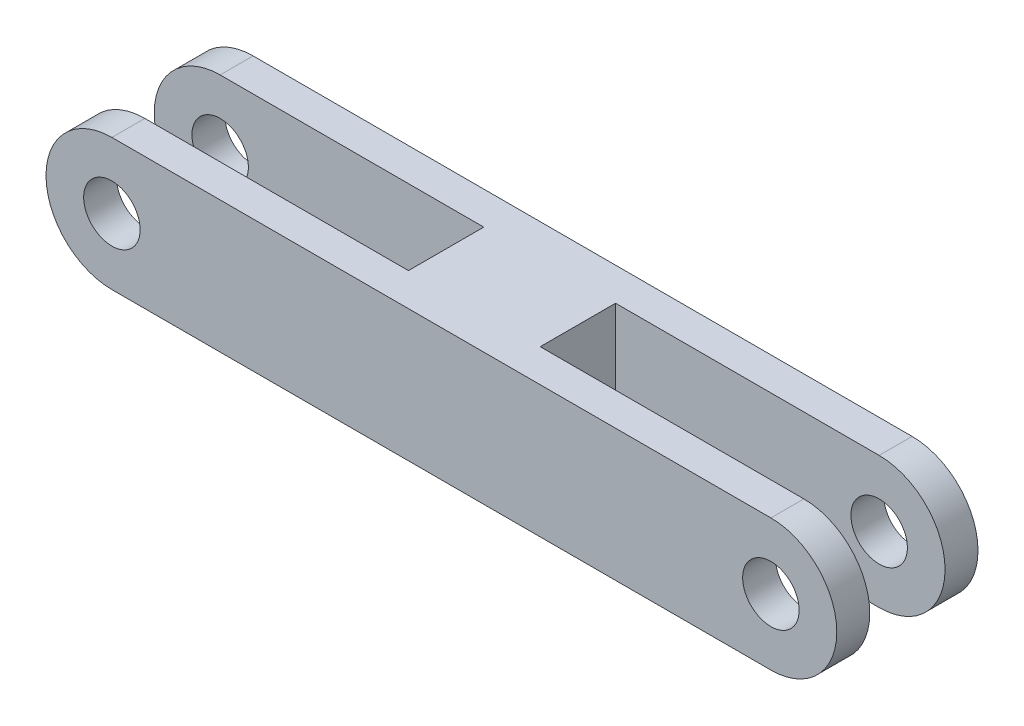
SolidWorks part; units mm, degrees
ref_plane "Front Plane" through (0, 0, 0) normal (0, 0, 1) x (1, 0, 0)
ref_plane "Top Plane" through (0, 0, 0) normal (0, 1, 0) x (1, 0, 0)
ref_plane "Right Plane" through (0, 0, 0) normal (1, 0, 0) x (0, 0, -1)
sketch "Sketch1" plane through (0, 0, 0) normal (0, 0, 1) x (1, 0, 0)
  line L0 (0, 0) -> (70, 0) construction
  line L1 (0, -7) -> (70, -7)
  line L2 (0, 7) -> (70, 7)
  arc A0 (0, -7) -> (0, 7) centre (0, 0) cw
  arc A1 (70, -7) -> (70, 7) centre (70, 0) ccw
  circle A2 centre (0, 0) radius 3
  circle A3 centre (70, 0) radius 3
  dimension "D4" = 6
  dimension "D3" = 70
  dimension "D1" = 7
  dimension "D2" = 7
extrude "Extrude1" add sketch "Sketch1" along normal mid plane 15
sketch "Sketch2" plane through (0, 7, 0) normal (0, 1, 0) x (-1, 0, 0)
  line L0 (-77, 0) -> (-42, 0) construction
  line L1 (-77, 7.5) -> (-77, -7.5) construction
  line L2 (-77, -4) -> (-42, -4)
  line L3 (-77, 4) -> (-42, 4)
  line L4 (-77, -4) -> (-77, 4)
  line L5 (-42, -4) -> (-42, 4)
  line L6 (-35, -7.5) -> (-35, -20.2216) construction
  line L7 (-70, -7.5) -> (0, -7.5) construction
  line L8 (7, -4) -> (7, 4)
  line L9 (7, 4) -> (-28, 4)
  line L10 (-28, -4) -> (-28, 4)
  line L11 (7, -4) -> (-28, -4)
  dimension "D3" = 35
  dimension "D1" = 4
  dimension "D2" = 4
extrude "Cut-Extrude1" cut sketch "Sketch2" against normal through all
